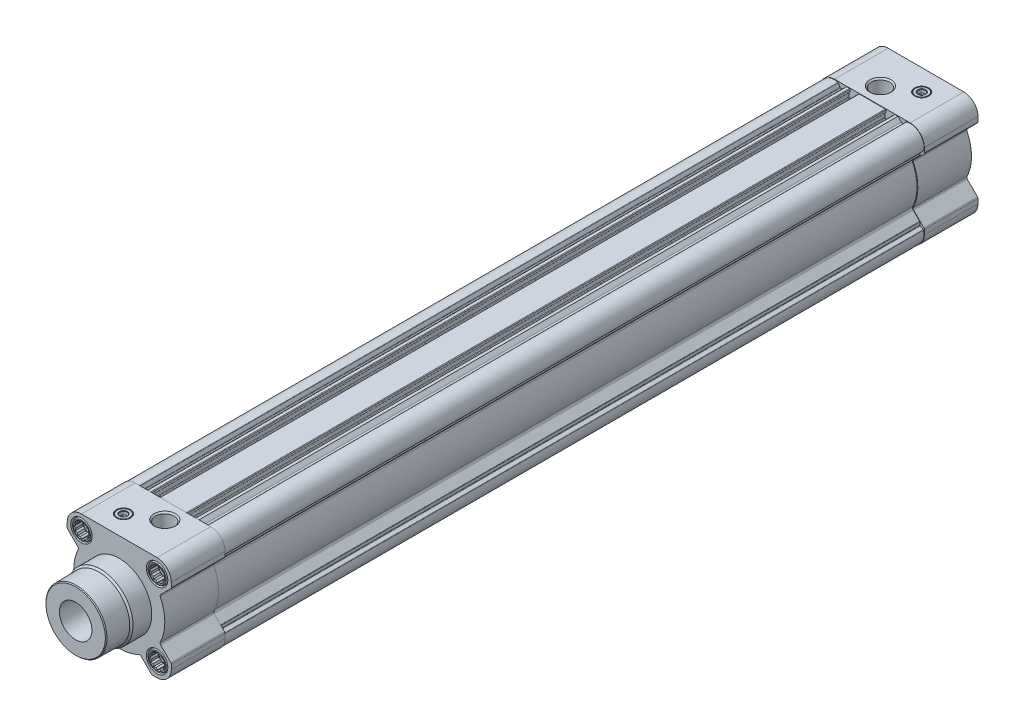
SolidWorks part; units mm, degrees
ref_plane "Plano frontal" through (0, 0, 0) normal (0, 0, 1) x (1, 0, 0)
ref_plane "Plano superior" through (0, 0, 0) normal (0, 1, 0) x (1, 0, 0)
ref_plane "Plano direito" through (0, 0, 0) normal (1, 0, 0) x (0, 0, -1)
imported_body "Bruto-CPME50-300-A-1"
split "Dividir1" bodies to split 101 resulting bodies 102 103
move or copy body "Corpo-Mover/Copiar1" bodies to move or copy 103 copy no translate (0, 0, 90)
sketch "Esboço1" plane through (0, 0, -283) normal (0, 0, 1) x (1, 0, 0)
  line L41 (-20.8477, -31.2378) -> (-19.8155, -29.45)
  line L42 (-29.45, -19.8155) -> (-31.2378, -20.8477)
  line L43 (-29.25, -17.7484) -> (-29.25, -19.4691)
  line L44 (-25.146, -13.4788) -> (-29.1328, -17.4656)
  line L45 (-29.1328, 17.4656) -> (-25.146, 13.4788)
  line L46 (-29.25, 19.4691) -> (-29.25, 17.7484)
  line L47 (-31.2378, 20.8477) -> (-29.45, 19.8155)
  line L48 (-19.8155, 29.45) -> (-20.8477, 31.2378)
  line L49 (-18.8713, 29.25) -> (-19.4691, 29.25)
  line L50 (-15.75, 31.75) -> (-17.8107, 29.6893)
  line L51 (-14, 31.75) -> (-15.75, 31.75)
  line L52 (-13.6, 30.15) -> (-13.6, 31.35)
  line L53 (-14.05, 29.95) -> (-13.8, 29.95)
  line L54 (-14.25, 27.15) -> (-14.25, 29.75)
  line L55 (-8.15, 26.75) -> (-13.85, 26.75)
  line L56 (-7.75, 29.75) -> (-7.75, 27.15)
  line L57 (-8.2, 29.95) -> (-7.95, 29.95)
  line L58 (-8.4, 31.35) -> (-8.4, 30.15)
  line L59 (8, 31.75) -> (-8, 31.75)
  line L60 (8.4, 30.15) -> (8.4, 31.35)
  line L61 (7.95, 29.95) -> (8.2, 29.95)
  line L62 (7.75, 27.15) -> (7.75, 29.75)
  line L63 (13.85, 26.75) -> (8.15, 26.75)
  line L64 (14.25, 29.75) -> (14.25, 27.15)
  line L65 (13.8, 29.95) -> (14.05, 29.95)
  line L66 (13.6, 31.35) -> (13.6, 30.15)
  line L67 (15.75, 31.75) -> (14, 31.75)
  line L68 (17.8107, 29.6893) -> (15.75, 31.75)
  line L69 (19.4691, 29.25) -> (18.8713, 29.25)
  line L70 (20.8477, 31.2378) -> (19.8155, 29.45)
  line L71 (29.45, 19.8155) -> (31.2378, 20.8477)
  line L72 (29.25, 17.7484) -> (29.25, 19.4691)
  line L73 (25.146, 13.4788) -> (29.1328, 17.4656)
  line L74 (29.1328, -17.4656) -> (25.146, -13.4788)
  line L75 (29.25, -19.4691) -> (29.25, -17.7484)
  line L76 (31.2378, -20.8477) -> (29.45, -19.8155)
  line L77 (19.8155, -29.45) -> (20.8477, -31.2378)
  line L78 (17.7484, -29.25) -> (19.4691, -29.25)
  line L79 (13.4788, -25.146) -> (17.4656, -29.1328)
  line L80 (-17.4656, -29.1328) -> (-13.4788, -25.146)
  line L81 (-19.4691, -29.25) -> (-17.7484, -29.25)
  line L123 (-20.8477, -31.2378) -> (-19.8155, -29.45)
  line L124 (-29.45, -19.8155) -> (-31.2378, -20.8477)
  line L125 (-29.25, -17.7484) -> (-29.25, -19.4691)
  line L126 (-25.146, -13.4788) -> (-29.1328, -17.4656)
  line L127 (-29.1328, 17.4656) -> (-25.146, 13.4788)
  line L128 (-29.25, 19.4691) -> (-29.25, 17.7484)
  line L129 (-31.2378, 20.8477) -> (-29.45, 19.8155)
  line L130 (-19.8155, 29.45) -> (-20.8477, 31.2378)
  line L131 (-18.8713, 29.25) -> (-19.4691, 29.25)
  line L132 (-15.75, 31.75) -> (-17.8107, 29.6893)
  line L133 (-14, 31.75) -> (-15.75, 31.75)
  line L134 (-13.6, 30.15) -> (-13.6, 31.35)
  line L135 (-14.05, 29.95) -> (-13.8, 29.95)
  line L136 (-14.25, 27.15) -> (-14.25, 29.75)
  line L137 (-8.15, 26.75) -> (-13.85, 26.75)
  line L138 (-7.75, 29.75) -> (-7.75, 27.15)
  line L139 (-8.2, 29.95) -> (-7.95, 29.95)
  line L140 (-8.4, 31.35) -> (-8.4, 30.15)
  line L141 (8, 31.75) -> (-8, 31.75)
  line L142 (8.4, 30.15) -> (8.4, 31.35)
  line L143 (7.95, 29.95) -> (8.2, 29.95)
  line L144 (7.75, 27.15) -> (7.75, 29.75)
  line L145 (13.85, 26.75) -> (8.15, 26.75)
  line L146 (14.25, 29.75) -> (14.25, 27.15)
  line L147 (13.8, 29.95) -> (14.05, 29.95)
  line L148 (13.6, 31.35) -> (13.6, 30.15)
  line L149 (15.75, 31.75) -> (14, 31.75)
  line L150 (17.8107, 29.6893) -> (15.75, 31.75)
  line L151 (19.4691, 29.25) -> (18.8713, 29.25)
  line L152 (20.8477, 31.2378) -> (19.8155, 29.45)
  line L153 (29.45, 19.8155) -> (31.2378, 20.8477)
  line L154 (29.25, 17.7484) -> (29.25, 19.4691)
  line L155 (25.146, 13.4788) -> (29.1328, 17.4656)
  line L156 (29.1328, -17.4656) -> (25.146, -13.4788)
  line L157 (29.25, -19.4691) -> (29.25, -17.7484)
  line L158 (31.2378, -20.8477) -> (29.45, -19.8155)
  line L159 (19.8155, -29.45) -> (20.8477, -31.2378)
  line L160 (17.7484, -29.25) -> (19.4691, -29.25)
  line L161 (13.4788, -25.146) -> (17.4656, -29.1328)
  line L162 (-17.4656, -29.1328) -> (-13.4788, -25.146)
  line L163 (-19.4691, -29.25) -> (-17.7484, -29.25)
  circle A2 centre (0, 0) radius 25 construction
  circle A3 centre (0, 0) radius 25
  arc A55 (-19.4691, -29.25) -> (-19.8155, -29.45) centre (-19.4691, -29.65) ccw
  arc A56 (-21.0831, -31.4221) -> (-20.8477, -31.2378) centre (-21.1941, -31.0378) ccw
  arc A57 (-31.4221, -21.0831) -> (-21.0831, -31.4221) centre (-23.4, -23.4) ccw
  arc A58 (-31.2378, -20.8477) -> (-31.4221, -21.0831) centre (-31.0378, -21.1941) ccw
  arc A59 (-29.45, -19.8155) -> (-29.25, -19.4691) centre (-29.65, -19.4691) ccw
  arc A60 (-29.1328, -17.4656) -> (-29.25, -17.7484) centre (-28.85, -17.7484) ccw
  arc A61 (-25.146, -13.4788) -> (-24.8512, -11.7758) centre (-26.2067, -12.4181) ccw
  arc A62 (-24.8512, 11.7758) -> (-24.8512, -11.7758) centre (0, 0) ccw
  arc A63 (-24.8512, 11.7758) -> (-25.146, 13.4788) centre (-26.2067, 12.4181) ccw
  arc A64 (-29.25, 17.7484) -> (-29.1328, 17.4656) centre (-28.85, 17.7484) ccw
  arc A65 (-29.25, 19.4691) -> (-29.45, 19.8155) centre (-29.65, 19.4691) ccw
  arc A66 (-31.4221, 21.0831) -> (-31.2378, 20.8477) centre (-31.0378, 21.1941) ccw
  arc A67 (-21.0831, 31.4221) -> (-31.4221, 21.0831) centre (-23.4, 23.4) ccw
  arc A68 (-20.8477, 31.2378) -> (-21.0831, 31.4221) centre (-21.1941, 31.0378) ccw
  arc A69 (-19.8155, 29.45) -> (-19.4691, 29.25) centre (-19.4691, 29.65) ccw
  arc A70 (-18.8713, 29.25) -> (-17.8107, 29.6893) centre (-18.8713, 30.75) ccw
  arc A71 (-13.6, 31.35) -> (-14, 31.75) centre (-14, 31.35) ccw
  arc A72 (-13.8, 29.95) -> (-13.6, 30.15) centre (-13.8, 30.15) ccw
  arc A73 (-14.05, 29.95) -> (-14.25, 29.75) centre (-14.05, 29.75) ccw
  arc A74 (-14.25, 27.15) -> (-13.85, 26.75) centre (-13.85, 27.15) ccw
  arc A75 (-8.15, 26.75) -> (-7.75, 27.15) centre (-8.15, 27.15) ccw
  arc A76 (-7.75, 29.75) -> (-7.95, 29.95) centre (-7.95, 29.75) ccw
  arc A77 (-8.4, 30.15) -> (-8.2, 29.95) centre (-8.2, 30.15) ccw
  arc A78 (-8, 31.75) -> (-8.4, 31.35) centre (-8, 31.35) ccw
  arc A79 (8.4, 31.35) -> (8, 31.75) centre (8, 31.35) ccw
  arc A80 (8.2, 29.95) -> (8.4, 30.15) centre (8.2, 30.15) ccw
  arc A81 (7.95, 29.95) -> (7.75, 29.75) centre (7.95, 29.75) ccw
  arc A82 (7.75, 27.15) -> (8.15, 26.75) centre (8.15, 27.15) ccw
  arc A83 (13.85, 26.75) -> (14.25, 27.15) centre (13.85, 27.15) ccw
  arc A84 (14.25, 29.75) -> (14.05, 29.95) centre (14.05, 29.75) ccw
  arc A85 (13.6, 30.15) -> (13.8, 29.95) centre (13.8, 30.15) ccw
  arc A86 (14, 31.75) -> (13.6, 31.35) centre (14, 31.35) ccw
  arc A87 (17.8107, 29.6893) -> (18.8713, 29.25) centre (18.8713, 30.75) ccw
  arc A88 (19.4691, 29.25) -> (19.8155, 29.45) centre (19.4691, 29.65) ccw
  arc A89 (21.0831, 31.4221) -> (20.8477, 31.2378) centre (21.1941, 31.0378) ccw
  arc A90 (31.4221, 21.0831) -> (21.0831, 31.4221) centre (23.4, 23.4) ccw
  arc A91 (31.2378, 20.8477) -> (31.4221, 21.0831) centre (31.0378, 21.1941) ccw
  arc A92 (29.45, 19.8155) -> (29.25, 19.4691) centre (29.65, 19.4691) ccw
  arc A93 (29.1328, 17.4656) -> (29.25, 17.7484) centre (28.85, 17.7484) ccw
  arc A94 (25.146, 13.4788) -> (24.8512, 11.7758) centre (26.2067, 12.4181) ccw
  arc A95 (24.8512, -11.7758) -> (24.8512, 11.7758) centre (0, 0) ccw
  arc A96 (24.8512, -11.7758) -> (25.146, -13.4788) centre (26.2067, -12.4181) ccw
  arc A97 (29.25, -17.7484) -> (29.1328, -17.4656) centre (28.85, -17.7484) ccw
  arc A98 (29.25, -19.4691) -> (29.45, -19.8155) centre (29.65, -19.4691) ccw
  arc A99 (31.4221, -21.0831) -> (31.2378, -20.8477) centre (31.0378, -21.1941) ccw
  arc A100 (21.0831, -31.4221) -> (31.4221, -21.0831) centre (23.4, -23.4) ccw
  arc A101 (20.8477, -31.2378) -> (21.0831, -31.4221) centre (21.1941, -31.0378) ccw
  arc A102 (19.8155, -29.45) -> (19.4691, -29.25) centre (19.4691, -29.65) ccw
  arc A103 (17.4656, -29.1328) -> (17.7484, -29.25) centre (17.7484, -28.85) ccw
  arc A104 (13.4788, -25.146) -> (11.7758, -24.8512) centre (12.4181, -26.2067) ccw
  arc A105 (-11.7758, -24.8512) -> (11.7758, -24.8512) centre (0, 0) ccw
  arc A159 (-11.7758, -24.8512) -> (-13.4788, -25.146) centre (-12.4181, -26.2067) ccw
  arc A160 (-17.7484, -29.25) -> (-17.4656, -29.1328) centre (-17.7484, -28.85) ccw
  arc A161 (-19.4691, -29.25) -> (-19.8155, -29.45) centre (-19.4691, -29.65) ccw
  arc A162 (-21.0831, -31.4221) -> (-20.8477, -31.2378) centre (-21.1941, -31.0378) ccw
  arc A163 (-31.4221, -21.0831) -> (-21.0831, -31.4221) centre (-23.4, -23.4) ccw
  arc A164 (-31.2378, -20.8477) -> (-31.4221, -21.0831) centre (-31.0378, -21.1941) ccw
  arc A165 (-29.45, -19.8155) -> (-29.25, -19.4691) centre (-29.65, -19.4691) ccw
  arc A166 (-29.1328, -17.4656) -> (-29.25, -17.7484) centre (-28.85, -17.7484) ccw
  arc A167 (-25.146, -13.4788) -> (-24.8512, -11.7758) centre (-26.2067, -12.4181) ccw
  arc A168 (-24.8512, 11.7758) -> (-24.8512, -11.7758) centre (0, 0) ccw
  arc A169 (-24.8512, 11.7758) -> (-25.146, 13.4788) centre (-26.2067, 12.4181) ccw
  arc A170 (-29.25, 17.7484) -> (-29.1328, 17.4656) centre (-28.85, 17.7484) ccw
  arc A171 (-29.25, 19.4691) -> (-29.45, 19.8155) centre (-29.65, 19.4691) ccw
  arc A172 (-31.4221, 21.0831) -> (-31.2378, 20.8477) centre (-31.0378, 21.1941) ccw
  arc A173 (-21.0831, 31.4221) -> (-31.4221, 21.0831) centre (-23.4, 23.4) ccw
  arc A174 (-20.8477, 31.2378) -> (-21.0831, 31.4221) centre (-21.1941, 31.0378) ccw
  arc A175 (-19.8155, 29.45) -> (-19.4691, 29.25) centre (-19.4691, 29.65) ccw
  arc A176 (-18.8713, 29.25) -> (-17.8107, 29.6893) centre (-18.8713, 30.75) ccw
  arc A177 (-13.6, 31.35) -> (-14, 31.75) centre (-14, 31.35) ccw
  arc A178 (-13.8, 29.95) -> (-13.6, 30.15) centre (-13.8, 30.15) ccw
  arc A179 (-14.05, 29.95) -> (-14.25, 29.75) centre (-14.05, 29.75) ccw
  arc A180 (-14.25, 27.15) -> (-13.85, 26.75) centre (-13.85, 27.15) ccw
  arc A181 (-8.15, 26.75) -> (-7.75, 27.15) centre (-8.15, 27.15) ccw
  arc A182 (-7.75, 29.75) -> (-7.95, 29.95) centre (-7.95, 29.75) ccw
  arc A183 (-8.4, 30.15) -> (-8.2, 29.95) centre (-8.2, 30.15) ccw
  arc A184 (-8, 31.75) -> (-8.4, 31.35) centre (-8, 31.35) ccw
  arc A185 (8.4, 31.35) -> (8, 31.75) centre (8, 31.35) ccw
  arc A186 (8.2, 29.95) -> (8.4, 30.15) centre (8.2, 30.15) ccw
  arc A187 (7.95, 29.95) -> (7.75, 29.75) centre (7.95, 29.75) ccw
  arc A188 (7.75, 27.15) -> (8.15, 26.75) centre (8.15, 27.15) ccw
  arc A189 (13.85, 26.75) -> (14.25, 27.15) centre (13.85, 27.15) ccw
  arc A190 (14.25, 29.75) -> (14.05, 29.95) centre (14.05, 29.75) ccw
  arc A191 (13.6, 30.15) -> (13.8, 29.95) centre (13.8, 30.15) ccw
  arc A192 (14, 31.75) -> (13.6, 31.35) centre (14, 31.35) ccw
  arc A193 (17.8107, 29.6893) -> (18.8713, 29.25) centre (18.8713, 30.75) ccw
  arc A194 (19.4691, 29.25) -> (19.8155, 29.45) centre (19.4691, 29.65) ccw
  arc A195 (21.0831, 31.4221) -> (20.8477, 31.2378) centre (21.1941, 31.0378) ccw
  arc A196 (31.4221, 21.0831) -> (21.0831, 31.4221) centre (23.4, 23.4) ccw
  arc A197 (31.2378, 20.8477) -> (31.4221, 21.0831) centre (31.0378, 21.1941) ccw
  arc A198 (29.45, 19.8155) -> (29.25, 19.4691) centre (29.65, 19.4691) ccw
  arc A199 (29.1328, 17.4656) -> (29.25, 17.7484) centre (28.85, 17.7484) ccw
  arc A200 (25.146, 13.4788) -> (24.8512, 11.7758) centre (26.2067, 12.4181) ccw
  arc A201 (24.8512, -11.7758) -> (24.8512, 11.7758) centre (0, 0) ccw
  arc A202 (24.8512, -11.7758) -> (25.146, -13.4788) centre (26.2067, -12.4181) ccw
  arc A203 (29.25, -17.7484) -> (29.1328, -17.4656) centre (28.85, -17.7484) ccw
  arc A204 (29.25, -19.4691) -> (29.45, -19.8155) centre (29.65, -19.4691) ccw
  arc A205 (31.4221, -21.0831) -> (31.2378, -20.8477) centre (31.0378, -21.1941) ccw
  arc A206 (21.0831, -31.4221) -> (31.4221, -21.0831) centre (23.4, -23.4) ccw
  arc A207 (20.8477, -31.2378) -> (21.0831, -31.4221) centre (21.1941, -31.0378) ccw
  arc A208 (19.8155, -29.45) -> (19.4691, -29.25) centre (19.4691, -29.65) ccw
  arc A209 (17.4656, -29.1328) -> (17.7484, -29.25) centre (17.7484, -28.85) ccw
  arc A210 (13.4788, -25.146) -> (11.7758, -24.8512) centre (12.4181, -26.2067) ccw
  arc A211 (-11.7758, -24.8512) -> (11.7758, -24.8512) centre (0, 0) ccw
  arc A212 (-11.7758, -24.8512) -> (-13.4788, -25.146) centre (-12.4181, -26.2067) ccw
  arc A213 (-17.7484, -29.25) -> (-17.4656, -29.1328) centre (-17.7484, -28.85) ccw
  dimension "D1" = 0
extrude "Ressalto-extrusão1" add sketch "Esboço1" against normal up to next
